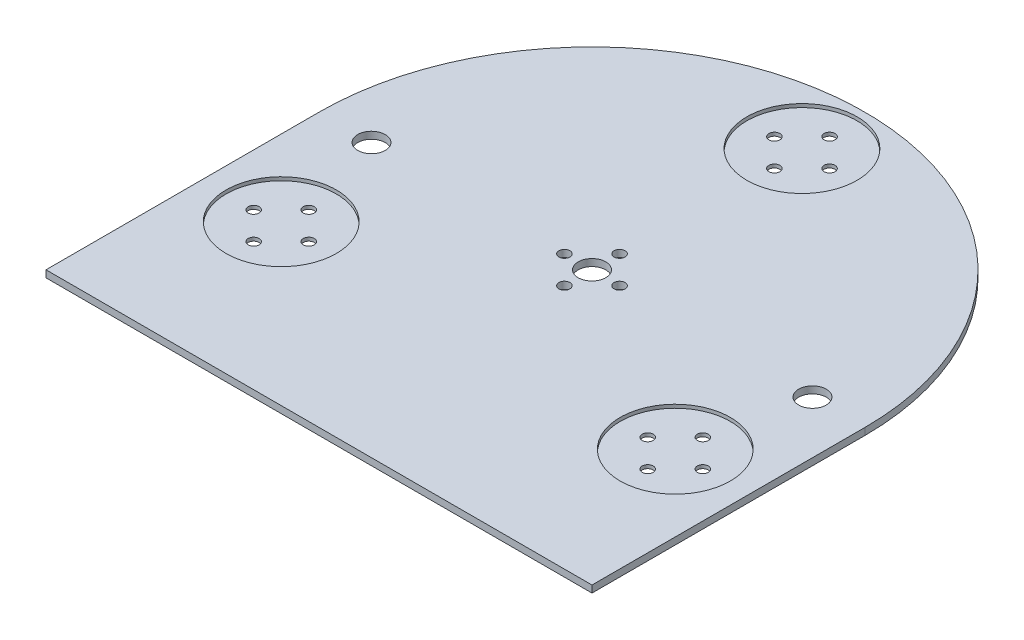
SolidWorks part; units mm, degrees
ref_plane "Front Plane" through (0, 0, 0) normal (0, 0, 1) x (1, 0, 0)
ref_plane "Top Plane" through (0, 0, 0) normal (0, 1, 0) x (1, 0, 0)
ref_plane "Right Plane" through (0, 0, 0) normal (1, 0, 0) x (0, 0, -1)
sketch "Sketch1" plane through (0, 0, 0) normal (0, 1, 0) x (1, 0, 0)
  line L1 (-99.06, 0) -> (99.06, 0)
  line L2 (-99.06, 0) -> (-99.06, -99.06)
  line L3 (-99.06, -99.06) -> (99.06, -99.06)
  line L4 (99.06, 0) -> (99.06, -99.06)
  circle A0 centre (0, 0) radius 99.06
  dimension "D1" = 198.12
extrude "Boss-Extrude1" add sketch "Sketch1" along normal blind 2.54 contours L1 A0 | A0 L1 | A0 L2 L3 | A0 L3 L4
sketch "Sketch2" plane through (0, 2.54, 0) normal (0, 1, 0) x (1, 0, 0)
  line L0 (0, -99.06) -> (0, 99.06) construction
  line L1 (-99.06, -99.06) -> (99.06, -99.06) construction
  line L2 (0, 0) -> (-71.4904, -41.275) construction
  line L3 (0, 0) -> (71.4904, -41.275) construction
  line L4 (0, 0) -> (-80.01, 0) construction
  line L5 (0, 0) -> (80.01, 0) construction
  line L6 (-99.06, 0) -> (-99.06, -99.06) construction
  arc A0 (99.06, 0) -> (-99.06, 0) centre (0, 0) ccw construction
  circle A1 centre (-71.4904, -41.275) radius 20
  circle A2 centre (71.4904, -41.275) radius 20
  circle A3 centre (0, 76.2) radius 20
  circle A4 centre (0, 0) radius 2.5
  circle A5 centre (-80.01, 0) radius 5
  circle A6 centre (80.01, 0) radius 5
  dimension "D1" = 40
  dimension "D7" = 10
  dimension "D8" = 5
  dimension "D2" = 120
  dimension "D3" = 120
  dimension "D4" = 82.55
  dimension "D5" = 76.2
  dimension "D6" = 19.05
extrude "Cut-Extrude1" cut sketch "Sketch2" against normal blind 1.27
sketch "Sketch3" plane through (0, 1.27, 0) normal (0, 1, 0) x (1, 0, 0)
  circle A0 centre (0, 0) radius 10 construction
  circle A1 centre (-71.4904, -41.275) radius 10 construction
  circle A2 centre (71.4904, -41.275) radius 10 construction
  circle A3 centre (0, 76.2) radius 10 construction
  circle A4 centre (-71.4904, -31.275) radius 2
  circle A5 centre (0, 10) radius 2
  circle A6 centre (0, 66.2) radius 2
  circle A7 centre (71.4904, -31.275) radius 2
  circle A8 centre (-61.4904, -41.275) radius 2
  circle A9 centre (-71.4904, -51.275) radius 2
  circle A10 centre (-81.4904, -41.275) radius 2
  circle A11 centre (10, 0) radius 2
  circle A12 centre (0, -10) radius 2
  circle A13 centre (-10, 0) radius 2
  circle A14 centre (-10, 76.2) radius 2
  circle A15 centre (0, 86.2) radius 2
  circle A16 centre (10, 76.2) radius 2
  circle A17 centre (81.4904, -41.275) radius 2
  circle A18 centre (71.4904, -51.275) radius 2
  circle A19 centre (61.4904, -41.275) radius 2
  circle A20 centre (0, 0) radius 5
  circle A21 centre (-80.01, 0) radius 5
  circle A22 centre (80.01, 0) radius 5
  circle A23 centre (-80.01, 0) radius 5 construction
  point P29 (-71.4904, -41.275)
  point P36 (0, 0)
  point P43 (0, 76.2)
  point P50 (71.4904, -41.275)
  dimension "D1" = 20
  dimension "D2" = 4
  dimension "D7" = 10
  dimension "D3" = 4
  dimension "D4" = 4
  dimension "D5" = 4
  dimension "D6" = 4
extrude "Cut-Extrude2" cut sketch "Sketch3" against normal through all both and the other way through all
